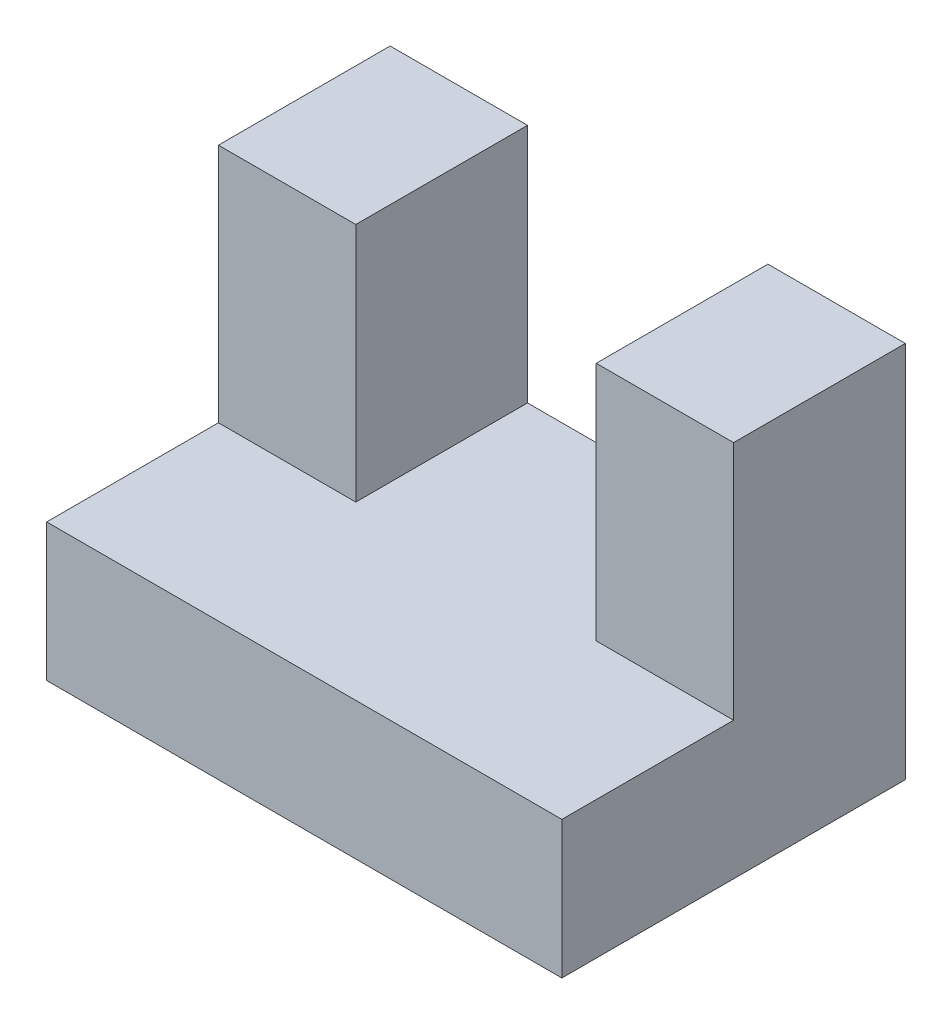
SolidWorks part; units mm, degrees
ref_plane "前视基准面" through (0, 0, 0) normal (0, 0, 1) x (1, 0, 0)
ref_plane "上视基准面" through (0, 0, 0) normal (0, 1, 0) x (1, 0, 0)
ref_plane "右视基准面" through (0, 0, 0) normal (1, 0, 0) x (0, 0, -1)
sketch "草图1" plane through (0, 0, 0) normal (0, 1, 0) x (1, 0, 0)
  line L1 (0, 0) -> (30, 0)
  line L2 (0, 0) -> (0, 20)
  line L3 (0, 20) -> (30, 20)
  line L4 (30, 0) -> (30, 20)
  dimension "D1" = 30
  dimension "D2" = 20
extrude "拉伸1" add sketch "草图1" along normal blind 8
sketch "草图2" plane through (0, 8, 0) normal (0, 1, 0) x (1, 0, 0)
  line L1 (0, 20) -> (8, 20)
  line L2 (0, 20) -> (0, 10)
  line L3 (0, 10) -> (8, 10)
  line L4 (8, 20) -> (8, 10)
  line L5 (30, 20) -> (22, 20)
  line L6 (30, 20) -> (30, 10)
  line L7 (30, 10) -> (22, 10)
  line L8 (22, 20) -> (22, 10)
  dimension "D1" = 14
  dimension "D2" = 8
  dimension "D3" = 10
extrude "拉伸2" add sketch "草图2" along normal blind 14
